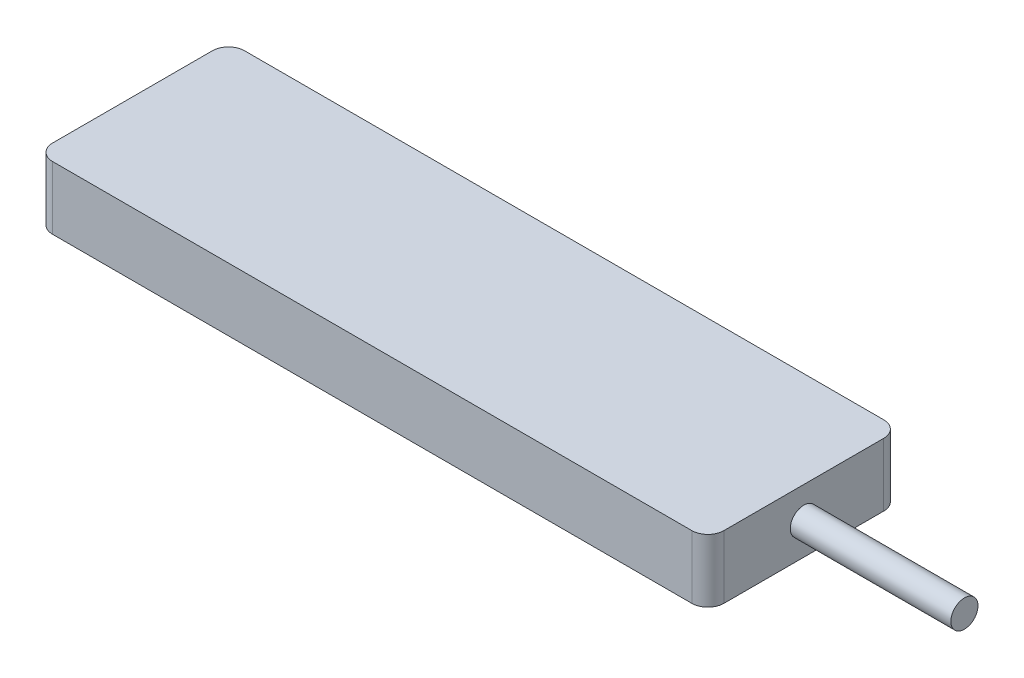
SolidWorks part; units mm, degrees
ref_plane "Front Plane" through (0, 0, 0) normal (0, 0, 1) x (1, 0, 0)
ref_plane "Top Plane" through (0, 0, 0) normal (0, 1, 0) x (1, 0, 0)
ref_plane "Right Plane" through (0, 0, 0) normal (1, 0, 0) x (0, 0, -1)
sketch "Sketch1" plane through (0, 0, 0) normal (0, 1, 0) x (1, 0, 0)
  line L1 (0, 0) -> (106.172, 0)
  line L2 (0, 0) -> (0, 30.353)
  line L3 (0, 30.353) -> (106.172, 30.353)
  line L4 (106.172, 0) -> (106.172, 30.353)
  dimension "D1" = 30.353
  dimension "D2" = 106.172
extrude "Boss-Extrude1" add sketch "Sketch1" along normal blind 9.9695
fillet "Fillet1" radius 2.54 4 edges at (0, 4.9848, 0) (0, 4.9848, -30.353) (106.172, 4.9848, -30.353) (106.172, 4.9848, 0)
sketch "Sketch2" plane through (0, 0, -30.353) normal (0, 0, -1) x (-1, 0, 0)
  line L0 (-63.7667, 7.5248) -> (-56.4642, 7.5248) construction
  line L1 (-76.3397, 2.4448) -> (-63.7667, 2.4448)
  line L2 (-76.3397, 2.4448) -> (-76.3397, 7.5248)
  line L3 (-76.3397, 7.5248) -> (-63.7667, 7.5248)
  line L4 (-63.7667, 2.4448) -> (-63.7667, 7.5248)
  line L5 (-56.4642, 2.4448) -> (-43.8912, 2.4448)
  line L6 (-56.4642, 2.4448) -> (-56.4642, 7.5248)
  line L7 (-56.4642, 7.5248) -> (-43.8912, 7.5248)
  line L8 (-43.8912, 2.4448) -> (-43.8912, 7.5248)
  line L9 (-36.5887, 2.4448) -> (-24.0157, 2.4448)
  line L10 (-36.5887, 2.4448) -> (-36.5887, 7.5248)
  line L11 (-36.5887, 7.5248) -> (-24.0157, 7.5248)
  line L12 (-24.0157, 2.4448) -> (-24.0157, 7.5248)
  line L13 (-16.7132, 2.4448) -> (-4.1402, 2.4448)
  line L14 (-16.7132, 2.4448) -> (-16.7132, 7.5248)
  line L15 (-16.7132, 7.5248) -> (-4.1402, 7.5248)
  line L16 (-4.1402, 2.4448) -> (-4.1402, 7.5248)
  line L17 (-43.8912, 7.5248) -> (-36.5887, 7.5248) construction
  line L18 (-24.0157, 7.5248) -> (-16.7132, 7.5248) construction
  line L19 (0, 9.9695) -> (0, 0) construction
  line L20 (-2.54, 0) -> (-2.54, 9.9695) construction
  point P20 (-2.54, 4.9848)
  point P21 (-4.1402, 4.9848)
  dimension "D1" = 12.573
  dimension "D2" = 5.08
  dimension "D3" = 7.3025
  dimension "D4" = 4.1402
extrude "Cut-Extrude1" cut sketch "Sketch2" against normal blind 8.636
sketch "Sketch3" plane through (106.172, 0, 0) normal (1, 0, 0) x (0, 0, -1)
  line L0 (2.54, 9.9695) -> (27.813, 9.9695) construction
  line L1 (2.54, 9.9695) -> (2.54, 0) construction
  circle A0 centre (15.1765, 4.9848) radius 2.1463
  point P5 (15.1765, 9.9695)
  point P8 (2.54, 4.9848)
  dimension "D1" = 4.2926
extrude "Boss-Extrude2" add sketch "Sketch3" along normal blind 25.4
